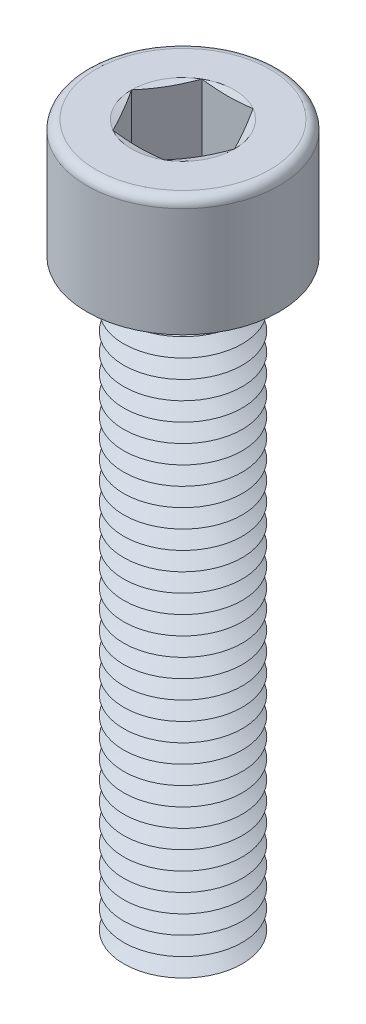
SolidWorks part; units mm, degrees
ref_plane "Front Plane" through (0, 0, 0) normal (0, 0, 1) x (1, 0, 0)
ref_plane "Top Plane" through (0, 0, 0) normal (0, 1, 0) x (1, 0, 0)
ref_plane "Right Plane" through (0, 0, 0) normal (1, 0, 0) x (0, 0, -1)
sketch "Sketch1" plane through (0, 0, 0) normal (0, 1, 0) x (1, 0, 0)
  circle A0 centre (0, 0) radius 4
  dimension "D1" = 8
extrude "Extrude1" add sketch "Sketch1" along normal blind 40
sketch "Sketch2" plane through (0, 40, 0) normal (0, 1, 0) x (1, 0, 0)
  circle A0 centre (0, 0) radius 6.5
  dimension "D1" = 13
extrude "Extrude2" add sketch "Sketch2" along normal blind 8
sketch "Sketch3" plane through (0, 48, 0) normal (0, 1, 0) x (1, 0, 0)
  line L1 (1.7321, 3) -> (-1.7321, 3)
  line L2 (-1.7321, 3) -> (-3.4641, 0)
  line L3 (-3.4641, 0) -> (-1.7321, -3)
  line L4 (-1.7321, -3) -> (1.7321, -3)
  line L5 (1.7321, -3) -> (3.4641, 0)
  line L6 (3.4641, 0) -> (1.7321, 3)
  circle A0 centre (0, 0) radius 3 construction
  dimension "D1" = 6
extrude "Extrude3" cut sketch "Sketch3" against normal blind 6
fillet "Fillet1" radius 0.625 1 edges at (0, 48, 6.5)
sketch "Sketch4" plane through (0, 0, 0) normal (1, 0, 0) x (0, 0, -1)
  line L0 (-3, 42) -> (0, 42)
  line L1 (0, 42) -> (0, 40.2679)
  line L2 (0, 40.2679) -> (-3, 42)
  dimension "D1" = 30
revolve "Cut-Revolve1" cut sketch "Sketch4" angle 360 about L1
sketch "Sketch5" plane through (0, 0, 0) normal (0, 0, 1) x (1, 0, 0)
  line L0 (-4, 0.625) -> (-4, -0.625)
  line L1 (-4, 40) -> (-4, 0) construction
  line L2 (-4, -0.625) -> (-2.9175, 0)
  line L3 (-4, 0) -> (4, 0) construction
  line L4 (-2.9175, 0) -> (-4, 0.625)
  dimension "D1" = 1.25
revolve "Cut-Revolve2" cut sketch "Sketch5" angle 360 about axis through (0, 40, 0) along (0, -1, 0)
pattern_linear "LPattern1" count 32 spacing 1.25 along (0, 1, 0) of "Cut-Revolve2"
sketch "Sketch6" plane through (0, 48, 0) normal (0, 1, 0) x (1, 0, 0)
  circle A0 centre (0, 0) radius 3.4641
extrude "Extrude4" cut sketch "Sketch6" against normal through all draft 75
